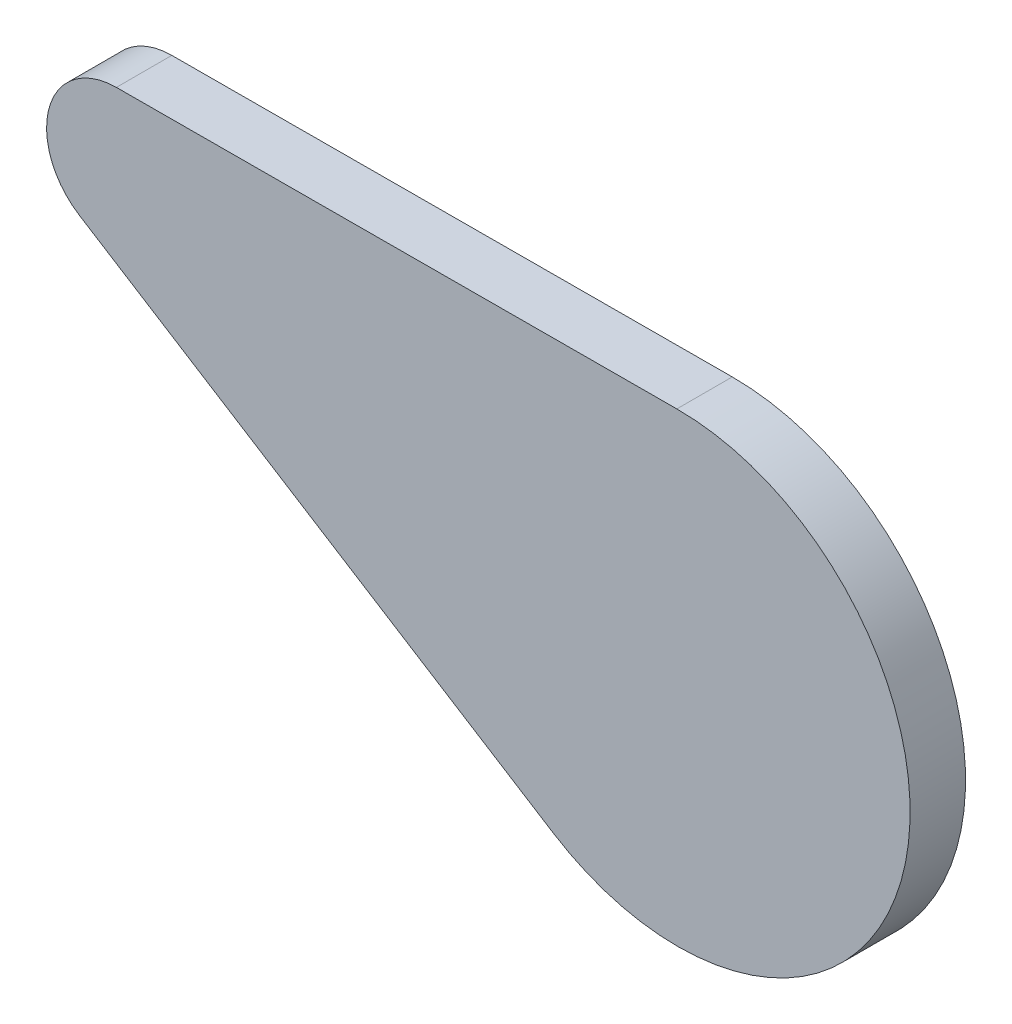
SolidWorks part; units mm, degrees
ref_plane "Plan de face" through (0, 0, 0) normal (0, 0, 1) x (1, 0, 0)
ref_plane "Plan de dessus" through (0, 0, 0) normal (0, 1, 0) x (1, 0, 0)
ref_plane "Plan de droite" through (0, 0, 0) normal (1, 0, 0) x (0, 0, -1)
sketch "Esquisse2" plane through (0, 0, 0) normal (0, 0, 1) x (1, 0, 0)
  line L0 (0, 0) -> (1, 0) construction
  line L1 (0, 0) -> (0, 1) construction
  line L2 (-22.3329, -35.5135) -> (-107.9243, 18.3111)
  line L3 (-101.2407, 41.6324) -> (-0.1325, 41.9518)
  arc A0 (-0.1325, 41.9518) -> (-22.3329, -35.5135) centre (0, 0) cw
  arc A1 (-107.9243, 18.3111) -> (-101.2407, 41.6324) centre (-101.2008, 29.0027) cw
extrude "Boss.-Extru.1" add sketch "Esquisse2" against normal blind 10
